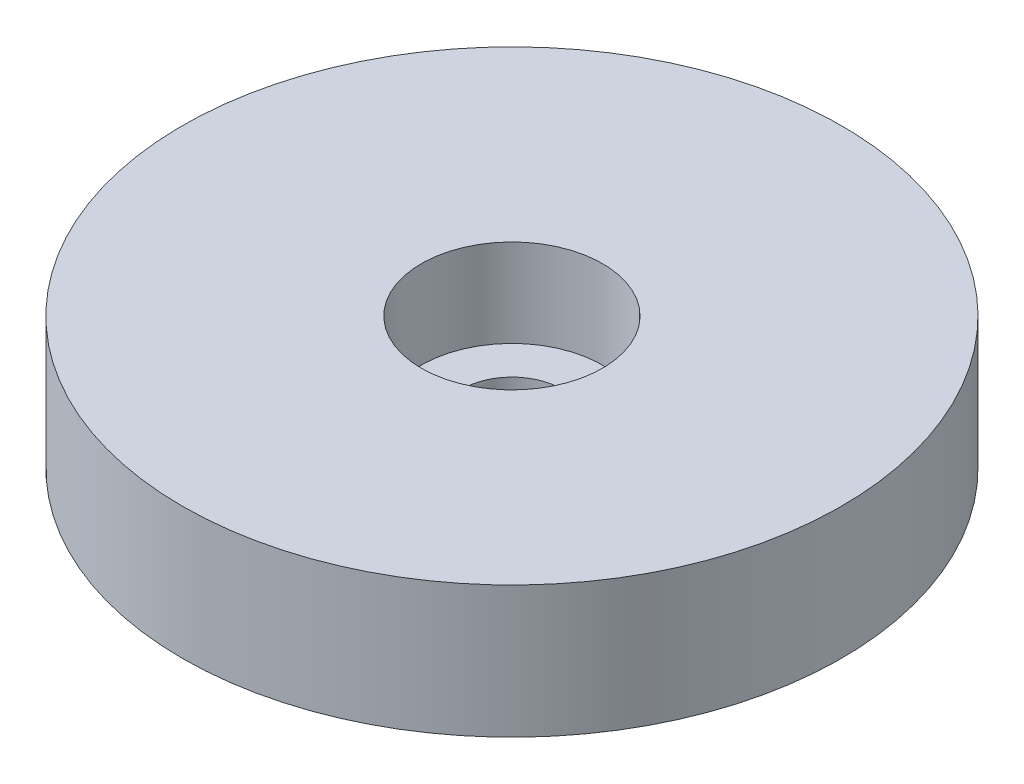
SolidWorks part; units mm, degrees
ref_plane "Front Plane" through (0, 0, 0) normal (0, 0, 1) x (1, 0, 0)
ref_plane "Top Plane" through (0, 0, 0) normal (0, 1, 0) x (1, 0, 0)
ref_plane "Right Plane" through (0, 0, 0) normal (1, 0, 0) x (0, 0, -1)
ref_plane "Bottom Plane" through (0, -60, 0) normal (0, 1, 0) x (1, 0, 0)
sketch "Sketch1" plane through (0, 0, 0) normal (0, 1, 0) x (1, 0, 0)
  circle A0 centre (0, 0) radius 15
  dimension "D1" = 30
extrude "Boss-Extrude1" add sketch "Sketch1" against normal blind 6
sketch "Sketch2" plane through (0, 0, 0) normal (1, 0, 0) x (0, 0, -1)
  line L1 (-15, 0) -> (-15, -6) construction
  line L2 (-15, -6) -> (15, -6) construction
  line L3 (-15, 0) -> (-15, -6) construction
  line L4 (15, -6) -> (15, 0) construction
  line L5 (15, -6) -> (15, 0) construction
  line L7 (0, 1.1931) -> (0, -13.1931) construction
  line L8 (-5, -6) -> (0, -6)
  line L9 (0, -6) -> (0, -11)
  arc A1 (-5, -6) -> (0, -11) centre (0, -6) ccw
  point P12 (0, -6)
  dimension "D1" = 5
revolve "Revolve2" add sketch "Sketch2" angle 360 about L9
sketch "Sketch3" plane through (0, 0, 0) normal (0, 1, 0) x (1, 0, 0)
  circle A0 centre (0, 0) radius 4.125
  dimension "D1" = 8.25
extrude "Cut-Extrude2" cut sketch "Sketch3" against normal blind 4
sketch "Sketch4" plane through (0, -4, 0) normal (0, 1, 0) x (1, 0, 0)
  circle A0 centre (0, 0) radius 2.25
  dimension "D1" = 4.5
extrude "Cut-Extrude3" cut sketch "Sketch4" against normal through all contours A0
